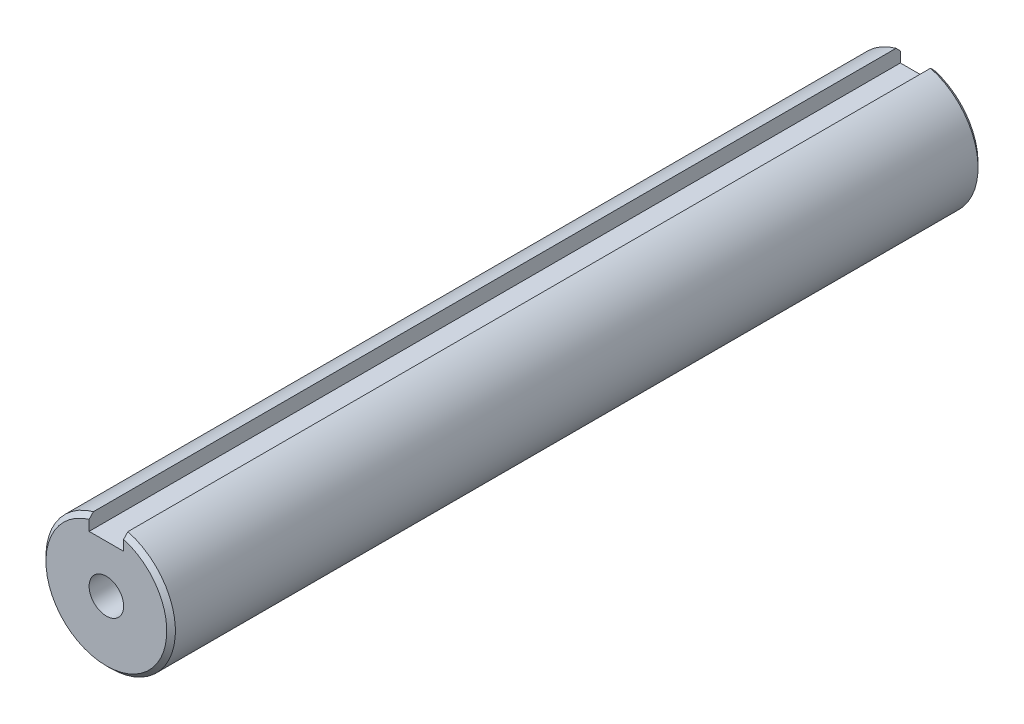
SolidWorks part; units mm, degrees
ref_plane "Plan de face" through (0, 0, 0) normal (0, 0, 1) x (1, 0, 0)
ref_plane "Plan de dessus" through (0, 0, 0) normal (0, 1, 0) x (1, 0, 0)
ref_plane "Plan de droite" through (0, 0, 0) normal (1, 0, 0) x (0, 0, -1)
sketch "Esquisse1" plane through (0, 0, 0) normal (0, 0, 1) x (1, 0, 0)
  line L0 (0, 0) -> (0, 22.7604) construction
  line L2 (-4, 14.4568) -> (-4, 11)
  line L3 (-4, 11) -> (4, 11)
  line L4 (4, 14.4568) -> (4, 11)
  arc A0 (-4, 14.4568) -> (4, 14.4568) centre (0, 0) ccw
  dimension "D1" = 30
  dimension "D2" = 11
  dimension "D3" = 8
extrude "Extrusion1" add sketch "Esquisse1" along normal mid plane 188
chamfer "Chanfrein1" distance 1 angle 45 2 edges at (0, -15, -94) (0, -15, 94)
hole_wizard "Trou taraudé M8x1.251" positions "Esquisse3" profile "Esquisse2" tap size "M8x1.25" standard "Ansi Métrique"
sketch "Esquisse3" plane through (0, 0, 94) normal (0, 0, 1) x (1, 0, 0)
  point P0 (0, 0)
sketch "Esquisse2" plane through (0, 0, 94) normal (1, 0, 0) x (0, -1, 0)
  line L0 (0, 0) -> (0, 27.0429)
  line L1 (0, 27.0429) -> (3.4, 25)
  line L2 (3.4, 25) -> (3.4, 20)
  line L3 (3.4, 20) -> (4, 20)
  line L4 (4, 20) -> (4, 0)
  line L5 (4, 0) -> (0, 0)
  line L10 (0, 27.0429) -> (-3.4, 25) construction
  line L11 (0, -6.35) -> (0, 107.95) construction
  dimension "Diamètre du trou pour taraudage" = 6.8
  dimension "Profondeur du trou pour taraudage" = 25
  dimension "Diamètre principal du filetage" = 8
  dimension "Profondeur du filetage" = 20
  dimension "Angle de pointe" = 118
sketch "Esquisse5" plane through (0, 0, -94) normal (0, 0, -1) x (-1, 0, 0)
  point P0 (0, 0)
hole_wizard "Trou taraudé M8x1.253" positions "Esquisse3D2" profile "Esquisse6" tap size "M8x1.25" standard "Ansi Métrique"
sketch3d "Esquisse3D2"
  point P0 (0, 0, -94)
sketch "Esquisse6" plane through (0, 0, -94) normal (1, 0, 0) x (0, 1, 0)
  line L0 (0, 0) -> (0, 27.0429)
  line L1 (0, 27.0429) -> (3.4, 25)
  line L2 (3.4, 25) -> (3.4, 20)
  line L3 (3.4, 20) -> (4, 20)
  line L4 (4, 20) -> (4, 0)
  line L5 (4, 0) -> (0, 0)
  line L10 (0, 27.0429) -> (-3.4, 25) construction
  line L11 (0, -6.35) -> (0, 107.95) construction
  dimension "Diamètre du trou pour taraudage" = 6.8
  dimension "Profondeur du trou pour taraudage" = 25
  dimension "Diamètre principal du filetage" = 8
  dimension "Profondeur du filetage" = 20
  dimension "Angle de pointe" = 118
